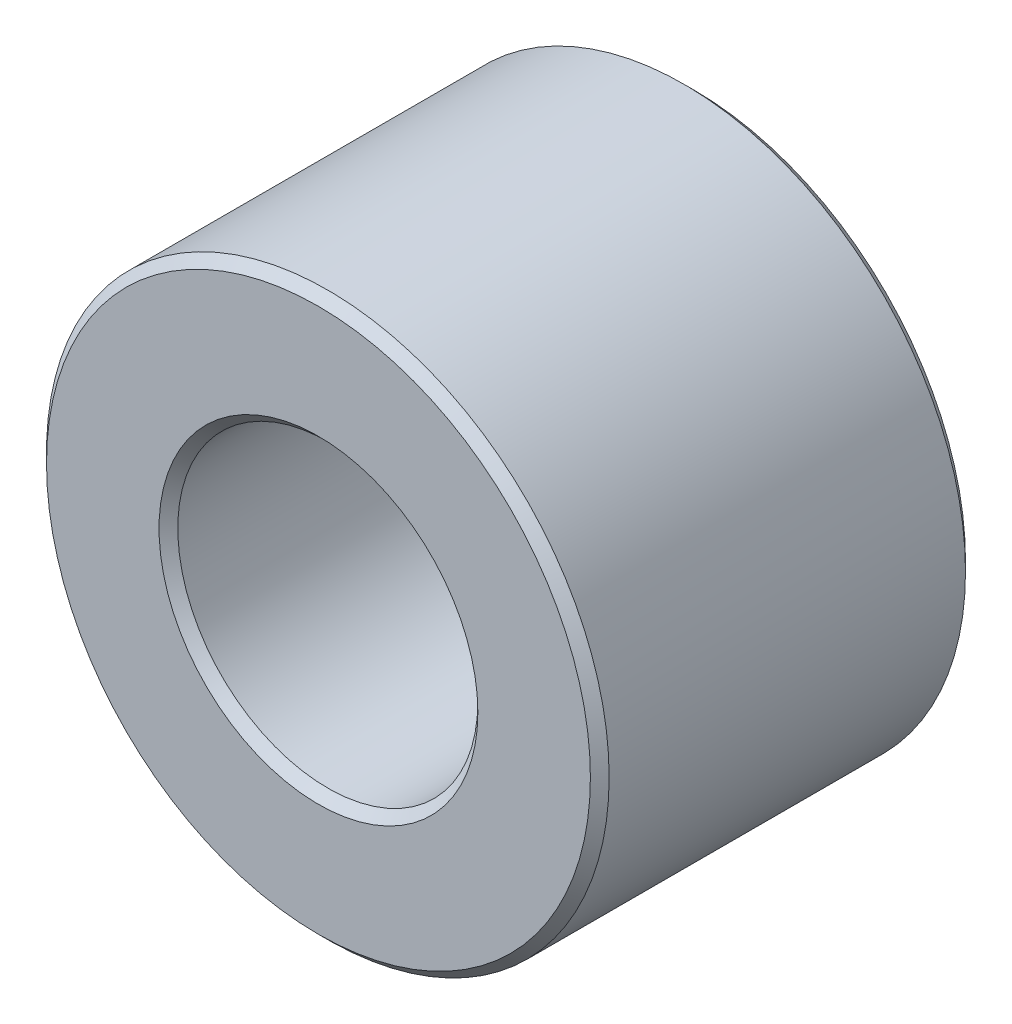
SolidWorks part; units mm, degrees
ref_plane "Front Plane" through (0, 0, 0) normal (0, 0, 1) x (1, 0, 0)
ref_plane "Top Plane" through (0, 0, 0) normal (0, 1, 0) x (1, 0, 0)
ref_plane "Right Plane" through (0, 0, 0) normal (1, 0, 0) x (0, 0, -1)
sketch "Sketch1" plane through (0, 0, 0) normal (0, 0, 1) x (1, 0, 0)
  circle A0 centre (0, 0) radius 3
  circle A1 centre (0, 0) radius 1.6
  dimension "D1" = 6
  dimension "D2" = 3.2
extrude "Boss-Extrude2" add sketch "Sketch1" along normal mid plane 4
chamfer "Chamfer3" distance 0.1 angle 45 4 edges at (3, 0, 2) (3, 0, -2) (1.6, 0, -2) (1.6, 0, 2)
